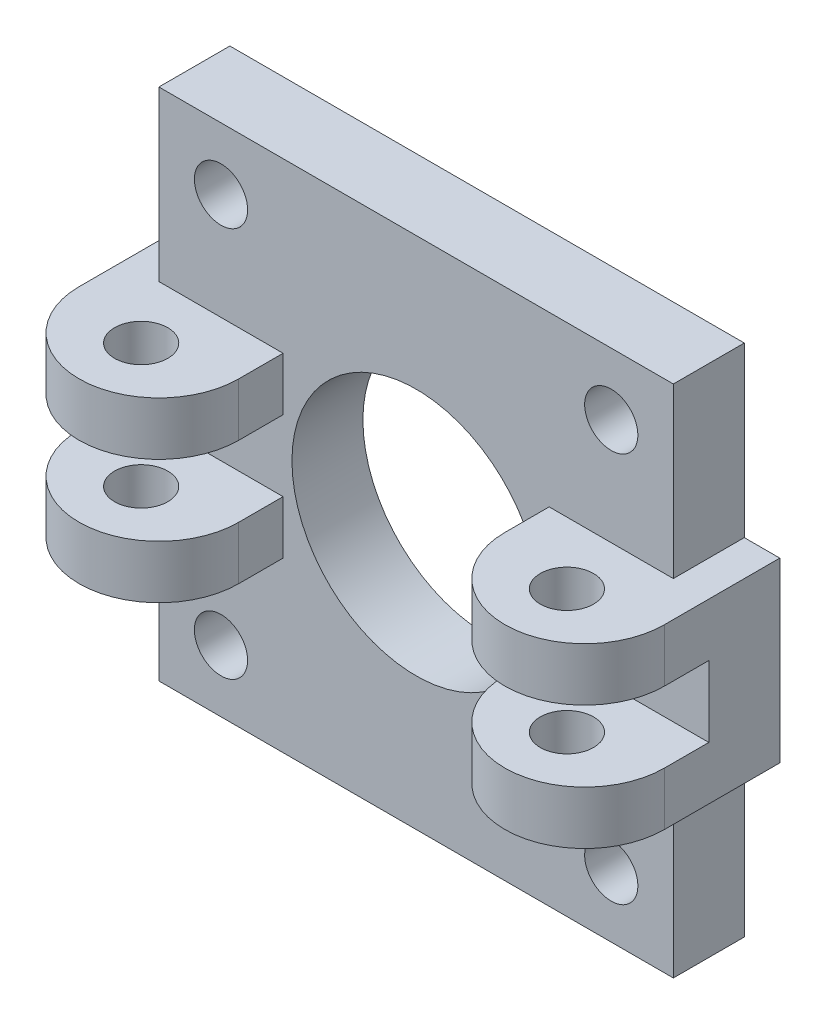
SolidWorks part; units mm, degrees
ref_plane "Спереди" through (0, 0, 0) normal (0, 0, 1) x (1, 0, 0)
ref_plane "Сверху" through (0, 0, 0) normal (0, 1, 0) x (1, 0, 0)
ref_plane "Справа" through (0, 0, 0) normal (1, 0, 0) x (0, 0, -1)
sketch "Эскиз1" plane through (0, 0, 0) normal (0, 0, 1) x (1, 0, 0)
  line L1 (-22.1232, 9.2757) -> (6.8768, 9.2757)
  line L2 (-22.1232, 9.2757) -> (-22.1232, -19.7243)
  line L3 (-22.1232, -19.7243) -> (6.8768, -19.7243)
  line L4 (6.8768, 9.2757) -> (6.8768, -19.7243)
  circle A0 centre (-7.6232, -5.2243) radius 9.5
  circle A1 centre (-7.6232, -5.2243) radius 7
  dimension "D4" = 19
  dimension "D5" = 14
  dimension "D1" = 29
  dimension "D2" = 29
  dimension "D3" = 14.5
extrude "Бобышка-Вытянуть2" add sketch "Эскиз1" along normal blind 4 contours L4 L1 L2 L3 A0 | A0 A1
sketch "Эскиз3" plane through (0, 0, 4) normal (0, 0, 1) x (1, 0, 0)
  line L0 (-7.0412, 4.2757) -> (-0.7069, 4.2757) construction
  line L1 (-22.1232, 9.2757) -> (6.8768, 9.2757) construction
  line L2 (-1024.7018, 5.7757) -> (48975.2982, 5.7757) construction
  line L3 (-18.6232, -991.4563) -> (-18.6232, 49008.5437) construction
  line L4 (3.3768, -991.3082) -> (3.3768, 49008.6918) construction
  line L5 (-1033.04, -16.2243) -> (48966.96, -16.2243) construction
  line L6 (-22.1232, -19.7243) -> (6.8768, -19.7243) construction
  line L7 (-22.1232, 9.2757) -> (-22.1232, -19.7243) construction
  line L8 (6.8768, 9.2757) -> (6.8768, -19.7243) construction
  circle A0 centre (-18.6232, 5.7757) radius 1.5
  circle A1 centre (3.3768, 5.7757) radius 1.5
  circle A2 centre (3.3768, -16.2243) radius 1.5
  circle A3 centre (-18.6232, -16.2243) radius 1.5
  dimension "D8" = 3
  dimension "D4" = 3
  dimension "D6" = 3
  dimension "D9" = 3
  dimension "D1" = 5
  dimension "D2" = 3.5
  dimension "D3" = 3.5
  dimension "D5" = 3.5
  dimension "D7" = 3.5
extrude "Вырез-Вытянуть1" cut sketch "Эскиз3" against normal blind 5
sketch "Эскиз4" plane through (0, 0, 4) normal (0, 0, 1) x (1, 0, 0)
  line L0 (-22.8498, -5.2243) -> (7.5764, -5.2243) construction
  line L1 (-22.1232, 9.2757) -> (6.8768, 9.2757) construction
  line L2 (-24.1232, -0.2243) -> (-15.1232, -0.2243)
  line L3 (-22.1232, 9.2757) -> (-22.1232, -19.7243) construction
  line L4 (-24.1232, -0.2243) -> (-24.1232, -10.2243)
  line L6 (-15.1232, -0.2243) -> (-15.1232, -10.2243)
  line L7 (-24.1232, -10.2243) -> (-15.1232, -10.2243)
  dimension "D1" = 14.5
  dimension "D2" = 7
  dimension "D3" = 5
  dimension "D4" = 10
  dimension "D5" = 2
  dimension "D6" = 9
extrude "Бобышка-Вытянуть3" add sketch "Эскиз4" along normal blind 7 and the other way up to surface
sketch "Эскиз5" plane through (0, 0, 11) normal (0, 0, 1) x (1, 0, 0)
  line L0 (-20.7787, -5.2243) -> (-14.2762, -5.2243) construction
  line L1 (-24.1232, -3.2243) -> (-15.1232, -3.2243)
  line L2 (-24.1232, -7.2243) -> (-15.1232, -7.2243)
  line L4 (-15.1232, -10.2243) -> (-15.1232, -0.2243)
  line L5 (-15.1232, -0.2243) -> (-24.1232, -0.2243)
  line L6 (-24.1232, -0.2243) -> (-24.1232, -10.2243)
  line L7 (-24.1232, -10.2243) -> (-15.1232, -10.2243)
  line L8 (-15.1232, -10.2243) -> (-15.1232, -0.2243)
  line L9 (-15.1232, -0.2243) -> (-24.1232, -0.2243)
  line L10 (-24.1232, -0.2243) -> (-24.1232, -10.2243)
  line L11 (-24.1232, -10.2243) -> (-15.1232, -10.2243)
  dimension "D2" = 5
  dimension "D3" = 2
  dimension "D4" = 2
  dimension "D5" = 9
  dimension "D6" = 3
  dimension "D1" = 0
extrude "Вырез-Вытянуть2" cut sketch "Эскиз5" against normal blind 7
sketch "Эскиз6" plane through (0, -0.2243, 0) normal (0, 1, 0) x (1, 0, 0)
  line L4 (-15.1232, -4) -> (-22.1232, -4)
  line L5 (-24.1232, 0) -> (-24.1232, -11)
  line L6 (-24.1232, -11) -> (-15.1232, -11)
  line L7 (-15.1232, -11) -> (-15.1232, -4)
  line L8 (-15.1232, -4) -> (-22.1232, -4)
  line L9 (-24.1232, 0) -> (-24.1232, -11)
  line L11 (-15.1232, -11) -> (-15.1232, -4)
  line L13 (-24.1232, -11) -> (-15.1232, -11)
  line L15 (-22.1232, 0) -> (-24.1232, 0)
  line L16 (-22.1232, 0) -> (-24.1232, 0)
  line L18 (-22.1232, -4) -> (-22.1232, 0)
  line L19 (-22.1232, -4) -> (-22.1232, 0)
  circle A0 centre (-19.6232, -7.5) radius 3.5
  circle A1 centre (-19.6232, -7.5) radius 1.5
  circle A3 centre (-19.6232, -6.5) radius 4.5
  dimension "D2" = 7
  dimension "D3" = 3
  dimension "D8" = 9
  dimension "D4" = 4.5
  dimension "D5" = 4.5
  dimension "D6" = 3.5
  dimension "D7" = 3.5
  dimension "D1" = 0
extrude "Вырез-Вытянуть3" cut sketch "Эскиз6" against normal up to surface (10 mm away) contours A1 | A3 L9 M7 | A3 M7 M8
sketch3d "Трехмерный эскиз1" [suppressed]
  line L0 (-7.6232, 9.2757, 4) -> (-7.6232, -19.7243, 4)
  line L1 (-22.1232, 9.2757, 4) -> (6.8768, 9.2757, 4) construction
  line L2 (-22.1232, -19.7243, 4) -> (6.8768, -19.7243, 4) construction
ref_plane "Плоскость1" [suppressed] through (-7.6232, 0, 0) normal (-1, 0, 0) x (0, 0, 1)
mirror "Зеркальное отражение1" about plane through (-7.6232, 0, 0) normal (-1, 0, 0) of "Бобышка-Вытянуть3", "Вырез-Вытянуть2", "Вырез-Вытянуть3"
